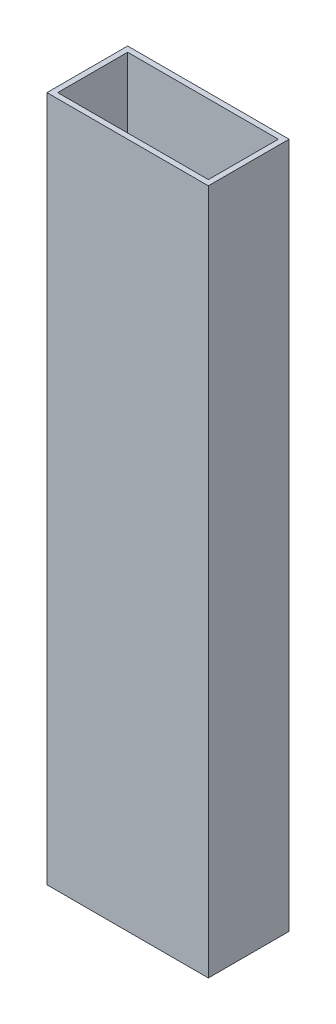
SolidWorks part; units mm, degrees
ref_plane "Front Plane" through (0, 0, 0) normal (0, 0, 1) x (1, 0, 0)
ref_plane "Top Plane" through (0, 0, 0) normal (0, 1, 0) x (1, 0, 0)
ref_plane "Right Plane" through (0, 0, 0) normal (1, 0, 0) x (0, 0, -1)
sketch "Sketch1" plane through (0, 0, 0) normal (0, 1, 0) x (1, 0, 0)
  line L0 (-28, 13) -> (28, 13)
  line L1 (-30, 15) -> (30, 15)
  line L2 (-30, 15) -> (-30, -15)
  line L3 (-30, -15) -> (30, -15)
  line L4 (30, 15) -> (30, -15)
  line L5 (-30, 15) -> (30, -15) construction
  line L6 (-30, -15) -> (30, 15) construction
  line L7 (28, 13) -> (28, -13)
  line L8 (-28, -13) -> (28, -13)
  line L9 (-28, 13) -> (-28, -13)
  point P4 (0, 0)
  point P5 (0, 0)
  dimension "D1" = 30
  dimension "D2" = 60
  dimension "D3" = 2
sketch "Sketch2" plane through (0, 0, 0) normal (0, 0, 1) x (1, 0, 0)
  line L0 (0, 0) -> (0, 255)
  dimension "D1" = 255
extrude "Boss-Extrude1" add sketch "Sketch1" along normal up to vertex (255 mm away)
